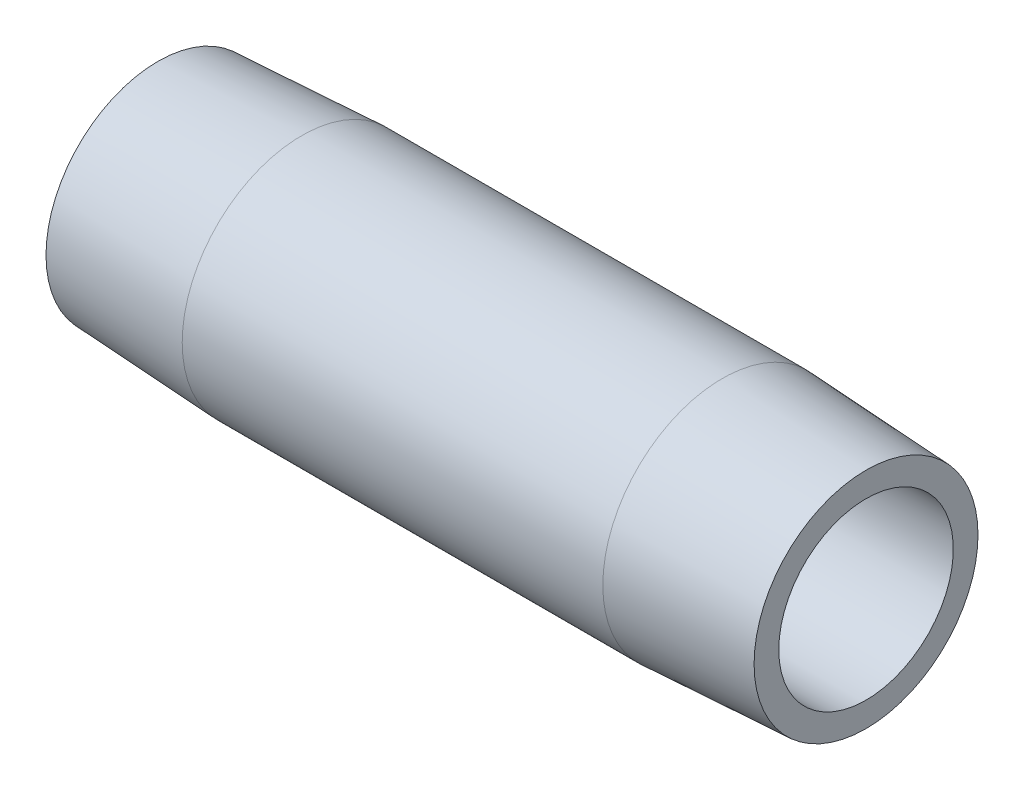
SolidWorks part; units mm, degrees
ref_plane "Front Plane" through (0, 0, 0) normal (0, 0, 1) x (1, 0, 0)
ref_plane "Top Plane" through (0, 0, 0) normal (0, 1, 0) x (1, 0, 0)
ref_plane "Right Plane" through (0, 0, 0) normal (1, 0, 0) x (0, 0, -1)
sketch "Sketch1" plane through (0, 0, 0) normal (0, 0, 1) x (1, 0, 0)
  line L5 (50.8, 6.2611) -> (0, 6.2611)
  line L6 (40.4876, 8.5725) -> (10.3124, 8.5725)
  line L7 (10.3124, 8.5725) -> (0, 8.0321)
  line L8 (50.8, 8.0321) -> (40.4876, 8.5725)
  line L9 (50.8, 6.2611) -> (50.8, 8.0321)
  line L10 (0, 6.2611) -> (0, 8.0321)
  line L11 (0, 0) -> (50000, 0) construction
  line L12 (0, -9.4297) -> (0, 9.4297) construction
  dimension "D1" = 12.5222
  dimension "D2" = 17.145
  dimension "D3" = 3
  dimension "D4" = 3
  dimension "D5" = 50.8
  dimension "D6" = 10.3124
  dimension "D7" = 10.3124
revolve "Revolve1" add sketch "Sketch1" angle 360 about L11
